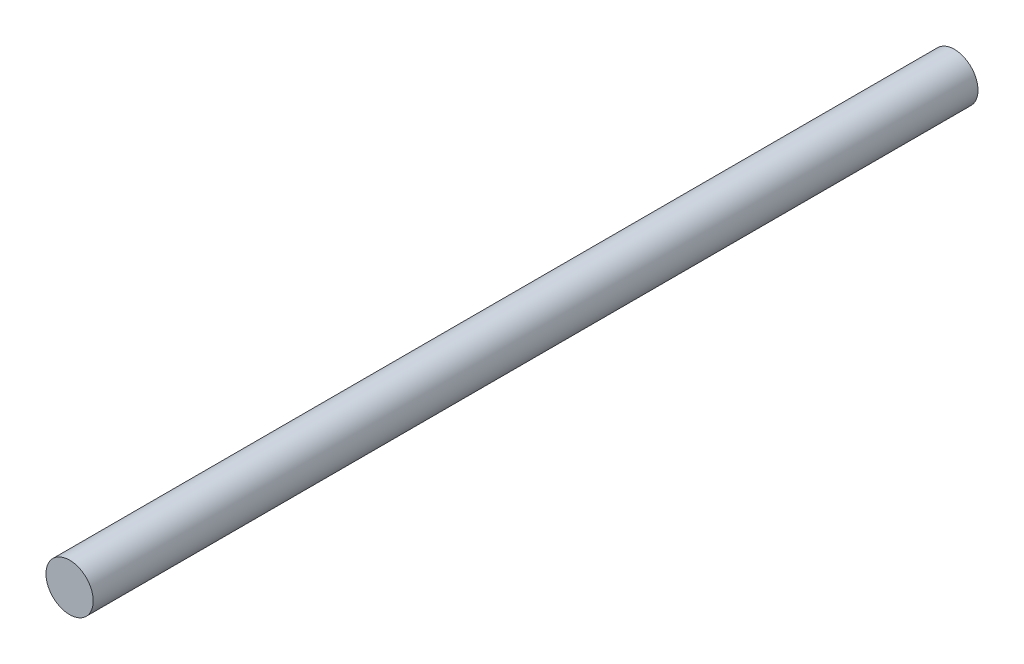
SolidWorks part; units mm, degrees
ref_plane "Plane1" through (0, 0, 0) normal (0, 0, 1) x (1, 0, 0)
ref_plane "Plane2" through (0, 0, 0) normal (0, 1, 0) x (1, 0, 0)
ref_plane "Plane3" through (0, 0, 0) normal (1, 0, 0) x (0, 0, -1)
sketch "Sketch1" plane through (0, 0, 0) normal (0, 0, 1) x (1, 0, 0)
  circle A0 centre (0, 0) radius 2.3749
  dimension "D1" = 4.7498
extrude "Base-Extrude" add sketch "Sketch1" along normal blind 88.9
